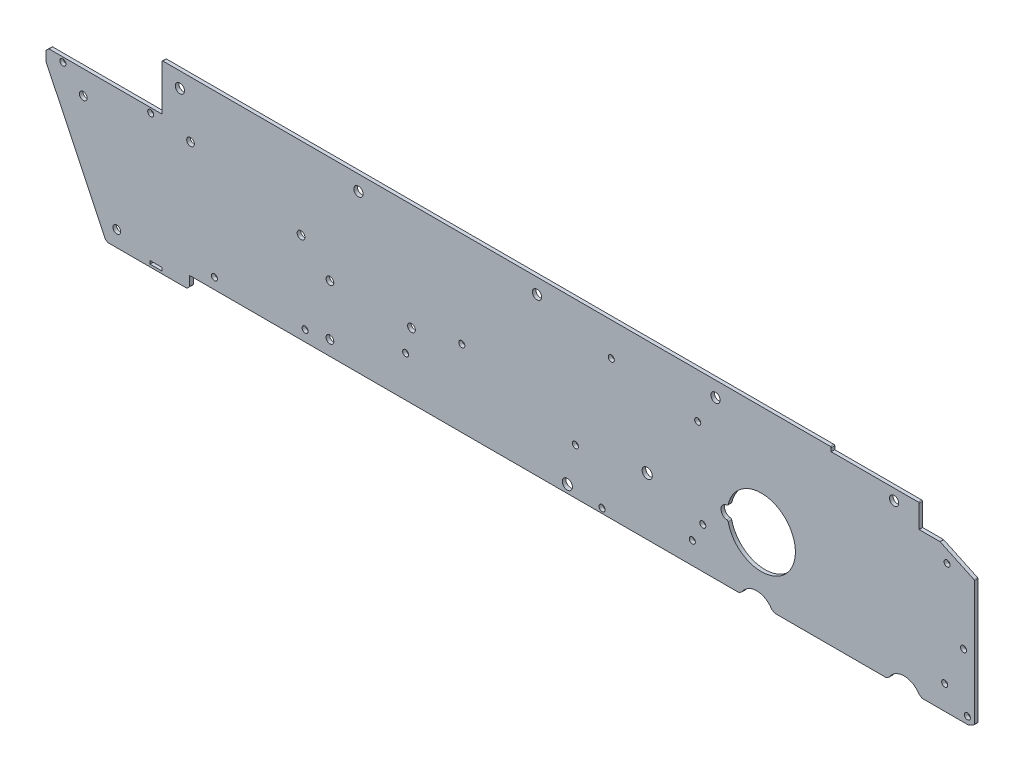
SolidWorks part; units mm, degrees
ref_plane "Plane1" through (0, 0, 0) normal (0, 0, 1) x (1, 0, 0)
ref_plane "Plane2" through (0, 0, 0) normal (0, 1, 0) x (1, 0, 0)
ref_plane "Plane3" through (0, 0, 0) normal (1, 0, 0) x (0, 0, -1)
sketch "Sketch1" plane through (0, 0, 0) normal (0, 0, 1) x (1, 0, 0)
  line L0 (0, 0) -> (0, -26.0096)
  line L1 (0, -26.0096) -> (-64.9986, -26.0096)
  line L2 (-64.9986, -26.0096) -> (-64.9986, -33.02)
  line L3 (-64.9986, -33.02) -> (-31.2674, -103.505)
  line L4 (-31.2674, -103.505) -> (15.494, -103.505)
  line L5 (15.494, -103.505) -> (15.494, -96.52)
  line L6 (15.494, -96.52) -> (454.9902, -96.52)
  line L7 (454.9902, -96.52) -> (454.9902, -24.511)
  line L8 (454.9902, -24.511) -> (435.7116, -15.494)
  line L9 (435.7116, -15.494) -> (424.0022, -15.494)
  line L10 (424.0022, -15.494) -> (424.0022, -2.3876)
  line L11 (424.0022, -2.3876) -> (374.777, -2.3876)
  line L12 (374.777, -2.3876) -> (374.777, 0)
  line L13 (374.777, 0) -> (0, 0)
  dimension "D1" = 439.7756
  dimension "D2" = 489.0008
  dimension "D3" = 500.7102
  dimension "D4" = 519.9888
  dimension "D5" = 64.9986
  dimension "D6" = 2.3876
  dimension "D7" = 26.0096
  dimension "D8" = 15.494
  dimension "D9" = 24.511
  dimension "D10" = 96.52
  dimension "D11" = 80.4926
  dimension "D12" = 103.505
  dimension "D13" = 33.7312
  dimension "D14" = 33.02
extrude "Base-Extrude" add sketch "Sketch1" along normal blind 2.286
sketch "Sketch2" plane through (0, 0, 2.286) normal (0, 0, 1) x (1, 0, 0)
  line L0 (454.9902, -96.52) -> (454.9902, -24.511) construction
  line L1 (15.494, -96.52) -> (454.9902, -96.52) construction
  circle A0 centre (415.6202, -100.33) radius 9.652
  dimension "D1" = 39.37
  dimension "D2" = 3.81
  dimension "D3" = 19.304
extrude "Cut-Extrude1" cut sketch "Sketch2" against normal through all
chamfer "Chamfer3" distance 1.524 angle 30 2 edges at (406.752, -96.52, 1.143) (424.4884, -96.52, 1.143)
pattern_linear "LPattern1" count 2 spacing 82.55 along (-1, 0, 0) of "Cut-Extrude1", "Chamfer3"
hole_wizard "Hole2" positions "Sketch6" profile "Sketch5" legacy
sketch "Sketch6" plane through (0, 0, 0) normal (0, 0, -1) x (-1, 0, 0)
  line L0 (-374.777, 0) -> (0, 0) construction
  line L1 (64.9986, -26.0096) -> (64.9986, -33.02) construction
  point P0 (-29.337, -90.424)
  dimension "D1" = 90.424
  dimension "D2" = 94.3356
sketch "Sketch5" plane through (29.337, -90.424, 0) normal (1, 0, 0) x (0, 1, 0)
  line L0 (0, 0) -> (0, 2.286)
  line L1 (0, 2.286) -> (1.5875, 2.286)
  line L2 (1.5875, 2.286) -> (1.5875, 1.5875)
  line L3 (1.5875, 1.5875) -> (3.175, 0)
  line L4 (3.175, 0) -> (0, 0)
  line L5 (0, -6.4453) -> (0, 115.525) construction
  line L6 (-1.5875, 1.5875) -> (-3.175, 0) construction
  dimension "Diameter" = 3.175
  dimension "Depth" = 2.286
  dimension "C-Sink Angle" = 90
  dimension "C-Sink Diameter" = 6.35
hole_wizard "Hole3" positions "Sketch8" profile "Sketch7" legacy
sketch "Sketch8" plane through (0, 0, 0) normal (0, 0, -1) x (-1, 0, 0)
  line L0 (-374.777, 0) -> (0, 0) construction
  line L1 (64.9986, -26.0096) -> (64.9986, -33.02) construction
  point P0 (-80.137, -90.424)
  dimension "D1" = 90.424
  dimension "D2" = 145.1356
sketch "Sketch7" plane through (80.137, -90.424, 0) normal (1, 0, 0) x (0, 1, 0)
  line L0 (0, 0) -> (0, 2.286)
  line L1 (0, 2.286) -> (1.5875, 2.286)
  line L2 (1.5875, 2.286) -> (1.5875, 1.5875)
  line L3 (1.5875, 1.5875) -> (3.175, 0)
  line L4 (3.175, 0) -> (0, 0)
  line L5 (0, -6.4453) -> (0, 115.525) construction
  line L6 (-1.5875, 1.5875) -> (-3.175, 0) construction
  dimension "Diameter" = 3.175
  dimension "Depth" = 2.286
  dimension "C-Sink Angle" = 90
  dimension "C-Sink Diameter" = 6.35
hole_wizard "Hole4" positions "Sketch10" profile "Sketch9" legacy
sketch "Sketch10" plane through (0, 0, 0) normal (0, 0, -1) x (-1, 0, 0)
  line L0 (64.9986, -26.0096) -> (64.9986, -33.02) construction
  line L1 (-374.777, 0) -> (0, 0) construction
  point P0 (55.5752, -28.6766)
  dimension "D1" = 9.4234
  dimension "D2" = 28.6766
sketch "Sketch9" plane through (-55.5752, -28.6766, 0) normal (1, 0, 0) x (0, 1, 0)
  line L0 (0, 0) -> (0, 2.286)
  line L1 (0, 2.286) -> (1.5875, 2.286)
  line L2 (1.5875, 2.286) -> (1.5875, 1.5875)
  line L3 (1.5875, 1.5875) -> (3.175, 0)
  line L4 (3.175, 0) -> (0, 0)
  line L5 (0, -6.4453) -> (0, 115.525) construction
  line L6 (-1.5875, 1.5875) -> (-3.175, 0) construction
  dimension "Diameter" = 3.175
  dimension "Depth" = 2.286
  dimension "C-Sink Angle" = 90
  dimension "C-Sink Diameter" = 6.35
hole_wizard "Hole5" positions "Sketch12" profile "Sketch11" legacy
sketch "Sketch12" plane through (0, 0, 0) normal (0, 0, -1) x (-1, 0, 0)
  line L0 (-374.777, 0) -> (0, 0) construction
  line L1 (64.9986, -26.0096) -> (64.9986, -33.02) construction
  point P0 (6.35, -28.6766)
  dimension "D1" = 28.6766
  dimension "D2" = 58.6486
sketch "Sketch11" plane through (-6.35, -28.6766, 0) normal (1, 0, 0) x (0, 1, 0)
  line L0 (0, 0) -> (0, 2.286)
  line L1 (0, 2.286) -> (1.5875, 2.286)
  line L2 (1.5875, 2.286) -> (1.5875, 1.5875)
  line L3 (1.5875, 1.5875) -> (3.175, 0)
  line L4 (3.175, 0) -> (0, 0)
  line L5 (0, -6.4453) -> (0, 115.525) construction
  line L6 (-1.5875, 1.5875) -> (-3.175, 0) construction
  dimension "Diameter" = 3.175
  dimension "Depth" = 2.286
  dimension "C-Sink Angle" = 90
  dimension "C-Sink Diameter" = 6.35
hole_wizard "Hole6" positions "Sketch14" profile "Sketch13" legacy
sketch "Sketch14" plane through (0, 0, 0) normal (0, 0, -1) x (-1, 0, 0)
  line L0 (-374.777, 0) -> (0, 0) construction
  line L1 (64.9986, -26.0096) -> (64.9986, -33.02) construction
  point P0 (-136.4488, -73.7108)
  dimension "D1" = 73.7108
  dimension "D2" = 201.4474
sketch "Sketch13" plane through (136.4488, -73.7108, 0) normal (1, 0, 0) x (0, 1, 0)
  line L0 (0, 0) -> (0, 2.286)
  line L1 (0, 2.286) -> (1.5875, 2.286)
  line L2 (1.5875, 2.286) -> (1.5875, 1.5875)
  line L3 (1.5875, 1.5875) -> (3.175, 0)
  line L4 (3.175, 0) -> (0, 0)
  line L5 (0, -6.4453) -> (0, 115.525) construction
  line L6 (-1.5875, 1.5875) -> (-3.175, 0) construction
  dimension "Diameter" = 3.175
  dimension "Depth" = 2.286
  dimension "C-Sink Angle" = 90
  dimension "C-Sink Diameter" = 6.35
hole_wizard "Hole7" positions "Sketch16" profile "Sketch15" legacy
sketch "Sketch16" plane through (0, 0, 0) normal (0, 0, -1) x (-1, 0, 0)
  line L0 (-374.777, 0) -> (0, 0) construction
  line L1 (64.9986, -26.0096) -> (64.9986, -33.02) construction
  point P0 (-246.4562, -93.853)
  dimension "D1" = 93.853
  dimension "D2" = 311.4548
sketch "Sketch15" plane through (246.4562, -93.853, 0) normal (1, 0, 0) x (0, 1, 0)
  line L0 (0, 0) -> (0, 2.286)
  line L1 (0, 2.286) -> (1.5875, 2.286)
  line L2 (1.5875, 2.286) -> (1.5875, 1.5875)
  line L3 (1.5875, 1.5875) -> (3.175, 0)
  line L4 (3.175, 0) -> (0, 0)
  line L5 (0, -6.4453) -> (0, 115.525) construction
  line L6 (-1.5875, 1.5875) -> (-3.175, 0) construction
  dimension "Diameter" = 3.175
  dimension "Depth" = 2.286
  dimension "C-Sink Angle" = 90
  dimension "C-Sink Diameter" = 6.35
hole_wizard "Hole8" positions "Sketch18" profile "Sketch17" legacy
sketch "Sketch18" plane through (0, 0, 0) normal (0, 0, -1) x (-1, 0, 0)
  line L0 (-425.6468, -96.52) -> (-454.9902, -96.52) construction
  line L1 (-454.9902, -96.52) -> (-454.9902, -24.511) construction
  point P0 (-451.0278, -92.5576)
  dimension "D1" = 3.9624
  dimension "D2" = 3.9624
sketch "Sketch17" plane through (451.0278, -92.5576, 0) normal (1, 0, 0) x (0, 1, 0)
  line L0 (0, 0) -> (0, 2.286)
  line L1 (0, 2.286) -> (1.5875, 2.286)
  line L2 (1.5875, 2.286) -> (1.5875, 1.5875)
  line L3 (1.5875, 1.5875) -> (3.175, 0)
  line L4 (3.175, 0) -> (0, 0)
  line L5 (0, -6.4453) -> (0, 115.525) construction
  line L6 (-1.5875, 1.5875) -> (-3.175, 0) construction
  dimension "Diameter" = 3.175
  dimension "Depth" = 2.286
  dimension "C-Sink Angle" = 90
  dimension "C-Sink Diameter" = 6.35
hole_wizard "Hole9" positions "Sketch20" profile "Sketch19" legacy
sketch "Sketch20" plane through (0, 0, 0) normal (0, 0, -1) x (-1, 0, 0)
  line L0 (-425.6468, -96.52) -> (-454.9902, -96.52) construction
  line L1 (-454.9902, -96.52) -> (-454.9902, -24.511) construction
  point P0 (-438.3278, -83.0072)
  dimension "D1" = 13.5128
  dimension "D2" = 16.6624
sketch "Sketch19" plane through (438.3278, -83.0072, 0) normal (1, 0, 0) x (0, 1, 0)
  line L0 (0, 0) -> (0, 2.286)
  line L1 (0, 2.286) -> (1.5875, 2.286)
  line L2 (1.5875, 2.286) -> (1.5875, 1.5875)
  line L3 (1.5875, 1.5875) -> (3.175, 0)
  line L4 (3.175, 0) -> (0, 0)
  line L5 (0, -6.4453) -> (0, 115.525) construction
  line L6 (-1.5875, 1.5875) -> (-3.175, 0) construction
  dimension "Diameter" = 3.175
  dimension "Depth" = 2.286
  dimension "C-Sink Angle" = 90
  dimension "C-Sink Diameter" = 6.35
hole_wizard "Hole10" positions "Sketch22" profile "Sketch21" legacy
sketch "Sketch22" plane through (0, 0, 0) normal (0, 0, -1) x (-1, 0, 0)
  line L0 (-454.9902, -96.52) -> (-454.9902, -24.511) construction
  line L1 (-425.6468, -96.52) -> (-454.9902, -96.52) construction
  point P0 (-448.8942, -60.96)
  dimension "D1" = 6.096
  dimension "D2" = 35.56
sketch "Sketch21" plane through (448.8942, -60.96, 0) normal (1, 0, 0) x (0, 1, 0)
  line L0 (0, 0) -> (0, 2.286)
  line L1 (0, 2.286) -> (1.5875, 2.286)
  line L2 (1.5875, 2.286) -> (1.5875, 1.5875)
  line L3 (1.5875, 1.5875) -> (3.175, 0)
  line L4 (3.175, 0) -> (0, 0)
  line L5 (0, -6.4453) -> (0, 115.525) construction
  line L6 (-1.5875, 1.5875) -> (-3.175, 0) construction
  dimension "Diameter" = 3.175
  dimension "Depth" = 2.286
  dimension "C-Sink Angle" = 90
  dimension "C-Sink Diameter" = 6.35
hole_wizard "Hole11" positions "Sketch24" profile "Sketch23" legacy
sketch "Sketch24" plane through (0, 0, 0) normal (0, 0, -1) x (-1, 0, 0)
  line L0 (-374.777, 0) -> (0, 0) construction
  line L1 (-454.9902, -96.52) -> (-454.9902, -24.511) construction
  point P0 (-439.674, -24.0792)
  dimension "D1" = 24.0792
  dimension "D2" = 15.3162
sketch "Sketch23" plane through (439.674, -24.0792, 0) normal (1, 0, 0) x (0, 1, 0)
  line L0 (0, 0) -> (0, 2.286)
  line L1 (0, 2.286) -> (1.5875, 2.286)
  line L2 (1.5875, 2.286) -> (1.5875, 1.5875)
  line L3 (1.5875, 1.5875) -> (3.175, 0)
  line L4 (3.175, 0) -> (0, 0)
  line L5 (0, -6.4453) -> (0, 115.525) construction
  line L6 (-1.5875, 1.5875) -> (-3.175, 0) construction
  dimension "Diameter" = 3.175
  dimension "Depth" = 2.286
  dimension "C-Sink Angle" = 90
  dimension "C-Sink Diameter" = 6.35
hole_wizard "Hole12" positions "Sketch26" profile "Sketch25" legacy
sketch "Sketch26" plane through (0, 0, 0) normal (0, 0, -1) x (-1, 0, 0)
  line L0 (-454.9902, -96.52) -> (-454.9902, -24.511) construction
  line L1 (-374.777, 0) -> (0, 0) construction
  point P0 (-296.9768, -84.2518)
  dimension "D1" = 158.0134
  dimension "D2" = 84.2518
sketch "Sketch25" plane through (296.9768, -84.2518, 0) normal (1, 0, 0) x (0, 1, 0)
  line L0 (0, 0) -> (0, 2.286)
  line L1 (0, 2.286) -> (1.5875, 2.286)
  line L2 (1.5875, 2.286) -> (1.5875, 1.5875)
  line L3 (1.5875, 1.5875) -> (3.175, 0)
  line L4 (3.175, 0) -> (0, 0)
  line L5 (0, -6.4453) -> (0, 115.525) construction
  line L6 (-1.5875, 1.5875) -> (-3.175, 0) construction
  dimension "Diameter" = 3.175
  dimension "Depth" = 2.286
  dimension "C-Sink Angle" = 90
  dimension "C-Sink Diameter" = 6.35
hole_wizard "Hole13" positions "Sketch28" profile "Sketch27" legacy
sketch "Sketch28" plane through (0, 0, 0) normal (0, 0, -1) x (-1, 0, 0)
  line L0 (-454.9902, -96.52) -> (-454.9902, -24.511) construction
  line L1 (-374.777, 0) -> (0, 0) construction
  point P0 (-302.8442, -73.6092)
  dimension "D1" = 152.146
  dimension "D2" = 73.6092
sketch "Sketch27" plane through (302.8442, -73.6092, 0) normal (1, 0, 0) x (0, 1, 0)
  line L0 (0, 0) -> (0, 2.286)
  line L1 (0, 2.286) -> (1.5875, 2.286)
  line L2 (1.5875, 2.286) -> (1.5875, 1.5875)
  line L3 (1.5875, 1.5875) -> (3.175, 0)
  line L4 (3.175, 0) -> (0, 0)
  line L5 (0, -6.4453) -> (0, 115.525) construction
  line L6 (-1.5875, 1.5875) -> (-3.175, 0) construction
  dimension "Diameter" = 3.175
  dimension "Depth" = 2.286
  dimension "C-Sink Angle" = 90
  dimension "C-Sink Diameter" = 6.35
hole_wizard "Hole14" positions "Sketch30" profile "Sketch29" legacy
sketch "Sketch30" plane through (0, 0, 0) normal (0, 0, -1) x (-1, 0, 0)
  line L0 (-374.777, 0) -> (0, 0) construction
  line L1 (-454.9902, -96.52) -> (-454.9902, -24.511) construction
  point P0 (-410.0068, -8.509)
  dimension "D1" = 8.509
  dimension "D2" = 44.9834
sketch "Sketch29" plane through (410.0068, -8.509, 0) normal (1, 0, 0) x (0, 1, 0)
  line L0 (0, 0) -> (0, 2.286)
  line L1 (0, 2.286) -> (2.159, 2.286)
  line L2 (2.159, 2.286) -> (2.159, 1.905)
  line L3 (2.159, 1.905) -> (4.064, 0)
  line L4 (4.064, 0) -> (0, 0)
  line L5 (0, -6.4453) -> (0, 115.525) construction
  line L6 (-2.159, 1.905) -> (-4.064, 0) construction
  dimension "Diameter" = 4.318
  dimension "Depth" = 2.286
  dimension "C-Sink Angle" = 90
  dimension "C-Sink Diameter" = 8.128
hole_wizard "Hole15" positions "Sketch32" profile "Sketch31" legacy
sketch "Sketch32" plane through (0, 0, 0) normal (0, 0, -1) x (-1, 0, 0)
  line L0 (-374.777, 0) -> (0, 0) construction
  line L1 (-454.9902, -96.52) -> (-454.9902, -24.511) construction
  point P0 (-309.9816, -8.509)
  dimension "D1" = 8.509
  dimension "D2" = 145.0086
sketch "Sketch31" plane through (309.9816, -8.509, 0) normal (1, 0, 0) x (0, 1, 0)
  line L0 (0, 0) -> (0, 2.286)
  line L1 (0, 2.286) -> (2.159, 2.286)
  line L2 (2.159, 2.286) -> (2.159, 1.905)
  line L3 (2.159, 1.905) -> (4.064, 0)
  line L4 (4.064, 0) -> (0, 0)
  line L5 (0, -6.4453) -> (0, 115.525) construction
  line L6 (-2.159, 1.905) -> (-4.064, 0) construction
  dimension "Diameter" = 4.318
  dimension "Depth" = 2.286
  dimension "C-Sink Angle" = 90
  dimension "C-Sink Diameter" = 8.128
hole_wizard "Hole16" positions "Sketch34" profile "Sketch33" legacy
sketch "Sketch34" plane through (0, 0, 0) normal (0, 0, -1) x (-1, 0, 0)
  line L0 (-374.777, 0) -> (0, 0) construction
  line L1 (-454.9902, -96.52) -> (-454.9902, -24.511) construction
  point P0 (-209.9818, -8.509)
  dimension "D1" = 8.509
  dimension "D2" = 245.0084
sketch "Sketch33" plane through (209.9818, -8.509, 0) normal (1, 0, 0) x (0, 1, 0)
  line L0 (0, 0) -> (0, 2.286)
  line L1 (0, 2.286) -> (2.159, 2.286)
  line L2 (2.159, 2.286) -> (2.159, 1.905)
  line L3 (2.159, 1.905) -> (4.064, 0)
  line L4 (4.064, 0) -> (0, 0)
  line L5 (0, -6.4453) -> (0, 115.525) construction
  line L6 (-2.159, 1.905) -> (-4.064, 0) construction
  dimension "Diameter" = 4.318
  dimension "Depth" = 2.286
  dimension "C-Sink Angle" = 90
  dimension "C-Sink Diameter" = 8.128
hole_wizard "Hole17" positions "Sketch36" profile "Sketch35" legacy
sketch "Sketch36" plane through (0, 0, 0) normal (0, 0, -1) x (-1, 0, 0)
  line L0 (-374.777, 0) -> (0, 0) construction
  line L1 (-454.9902, -96.52) -> (-454.9902, -24.511) construction
  point P0 (-109.982, -8.509)
  dimension "D1" = 8.509
  dimension "D2" = 345.0082
sketch "Sketch35" plane through (109.982, -8.509, 0) normal (1, 0, 0) x (0, 1, 0)
  line L0 (0, 0) -> (0, 2.286)
  line L1 (0, 2.286) -> (2.159, 2.286)
  line L2 (2.159, 2.286) -> (2.159, 1.905)
  line L3 (2.159, 1.905) -> (4.064, 0)
  line L4 (4.064, 0) -> (0, 0)
  line L5 (0, -6.4453) -> (0, 115.525) construction
  line L6 (-2.159, 1.905) -> (-4.064, 0) construction
  dimension "Diameter" = 4.318
  dimension "Depth" = 2.286
  dimension "C-Sink Angle" = 90
  dimension "C-Sink Diameter" = 8.128
hole_wizard "Hole18" positions "Sketch38" profile "Sketch37" legacy
sketch "Sketch38" plane through (0, 0, 0) normal (0, 0, -1) x (-1, 0, 0)
  line L0 (-374.777, 0) -> (0, 0) construction
  line L1 (-454.9902, -96.52) -> (-454.9902, -24.511) construction
  point P0 (-9.9822, -8.509)
  dimension "D1" = 8.509
  dimension "D2" = 445.008
sketch "Sketch37" plane through (9.9822, -8.509, 0) normal (1, 0, 0) x (0, 1, 0)
  line L0 (0, 0) -> (0, 2.286)
  line L1 (0, 2.286) -> (2.159, 2.286)
  line L2 (2.159, 2.286) -> (2.159, 1.905)
  line L3 (2.159, 1.905) -> (4.064, 0)
  line L4 (4.064, 0) -> (0, 0)
  line L5 (0, -6.4453) -> (0, 115.525) construction
  line L6 (-2.159, 1.905) -> (-4.064, 0) construction
  dimension "Diameter" = 4.318
  dimension "Depth" = 2.286
  dimension "C-Sink Angle" = 90
  dimension "C-Sink Diameter" = 8.128
hole_wizard "Hole19" positions "Sketch40" profile "Sketch39" legacy
sketch "Sketch40" plane through (0, 0, 0) normal (0, 0, -1) x (-1, 0, 0)
  line L0 (-374.777, 0) -> (0, 0) construction
  line L1 (-454.9902, -96.52) -> (-454.9902, -24.511) construction
  point P0 (44.1452, -39.243)
  dimension "D1" = 39.243
  dimension "D2" = 499.1354
sketch "Sketch39" plane through (-44.1452, -39.243, 0) normal (1, 0, 0) x (0, 1, 0)
  line L0 (0, 0) -> (0, 2.286)
  line L1 (0, 2.286) -> (2.159, 2.286)
  line L2 (2.159, 2.286) -> (2.159, 0)
  line L3 (2.159, 0) -> (0, 0)
  line L4 (0, 110) -> (0, -10) construction
  dimension "Diameter" = 4.318
  dimension "Depth" = 2.286
hole_wizard "Hole20" positions "Sketch43" profile "Sketch42" legacy
sketch "Sketch43" plane through (0, 0, 0) normal (0, 0, -1) x (-1, 0, 0)
  line L0 (-374.777, 0) -> (0, 0) construction
  line L1 (-454.9902, -96.52) -> (-454.9902, -24.511) construction
  point P0 (-15.9512, -31.4706)
  dimension "D1" = 31.4706
  dimension "D2" = 439.039
sketch "Sketch42" plane through (15.9512, -31.4706, 0) normal (1, 0, 0) x (0, 1, 0)
  line L0 (0, 0) -> (0, 2.286)
  line L1 (0, 2.286) -> (2.159, 2.286)
  line L2 (2.159, 2.286) -> (2.159, 0)
  line L3 (2.159, 0) -> (0, 0)
  line L4 (0, 110) -> (0, -10) construction
  dimension "Diameter" = 4.318
  dimension "Depth" = 2.286
hole_wizard "Hole21" positions "Sketch45" profile "Sketch44" legacy
sketch "Sketch45" plane through (0, 0, 0) normal (0, 0, -1) x (-1, 0, 0)
  line L0 (-374.777, 0) -> (0, 0) construction
  line L1 (-454.9902, -96.52) -> (-454.9902, -24.511) construction
  point P0 (25.3492, -94.615)
  dimension "D1" = 94.615
  dimension "D2" = 480.3394
sketch "Sketch44" plane through (-25.3492, -94.615, 0) normal (1, 0, 0) x (0, 1, 0)
  line L0 (0, 0) -> (0, 2.286)
  line L1 (0, 2.286) -> (2.159, 2.286)
  line L2 (2.159, 2.286) -> (2.159, 0)
  line L3 (2.159, 0) -> (0, 0)
  line L4 (0, 110) -> (0, -10) construction
  dimension "Diameter" = 4.318
  dimension "Depth" = 2.286
hole_wizard "Hole22" positions "Sketch47" profile "Sketch46" legacy
sketch "Sketch47" plane through (0, 0, 0) normal (0, 0, -1) x (-1, 0, 0)
  line L0 (-374.777, 0) -> (0, 0) construction
  line L1 (-454.9902, -96.52) -> (-454.9902, -24.511) construction
  point P0 (-94.0308, -88.265)
  dimension "D1" = 88.265
  dimension "D2" = 360.9594
sketch "Sketch46" plane through (94.0308, -88.265, 0) normal (1, 0, 0) x (0, 1, 0)
  line L0 (0, 0) -> (0, 2.286)
  line L1 (0, 2.286) -> (2.159, 2.286)
  line L2 (2.159, 2.286) -> (2.159, 0)
  line L3 (2.159, 0) -> (0, 0)
  line L4 (0, 110) -> (0, -10) construction
  dimension "Diameter" = 4.318
  dimension "Depth" = 2.286
hole_wizard "Hole23" positions "Sketch49" profile "Sketch48" legacy
sketch "Sketch49" plane through (0, 0, 0) normal (0, 0, -1) x (-1, 0, 0)
  line L0 (-374.777, 0) -> (0, 0) construction
  line L1 (-454.9902, -96.52) -> (-454.9902, -24.511) construction
  point P0 (-94.0308, -59.817)
  dimension "D1" = 59.817
  dimension "D2" = 360.9594
sketch "Sketch48" plane through (94.0308, -59.817, 0) normal (1, 0, 0) x (0, 1, 0)
  line L0 (0, 0) -> (0, 2.286)
  line L1 (0, 2.286) -> (2.159, 2.286)
  line L2 (2.159, 2.286) -> (2.159, 0)
  line L3 (2.159, 0) -> (0, 0)
  line L4 (0, 110) -> (0, -10) construction
  dimension "Diameter" = 4.318
  dimension "Depth" = 2.286
hole_wizard "Hole24" positions "Sketch51" profile "Sketch50" legacy
sketch "Sketch51" plane through (0, 0, 0) normal (0, 0, -1) x (-1, 0, 0)
  line L0 (-374.777, 0) -> (0, 0) construction
  line L1 (-454.9902, -96.52) -> (-454.9902, -24.511) construction
  point P0 (-77.8256, -45.7708)
  dimension "D1" = 45.7708
  dimension "D2" = 377.1646
sketch "Sketch50" plane through (77.8256, -45.7708, 0) normal (1, 0, 0) x (0, 1, 0)
  line L0 (0, 0) -> (0, 2.286)
  line L1 (0, 2.286) -> (2.159, 2.286)
  line L2 (2.159, 2.286) -> (2.159, 0)
  line L3 (2.159, 0) -> (0, 0)
  line L4 (0, 110) -> (0, -10) construction
  dimension "Diameter" = 4.318
  dimension "Depth" = 2.286
hole_wizard "Hole25" positions "Sketch53" profile "Sketch52" legacy
sketch "Sketch53" plane through (0, 0, 0) normal (0, 0, -1) x (-1, 0, 0)
  line L0 (-374.777, 0) -> (0, 0) construction
  line L1 (-454.9902, -96.52) -> (-454.9902, -24.511) construction
  point P0 (-139.7, -59.817)
  dimension "D1" = 59.817
  dimension "D2" = 315.2902
sketch "Sketch52" plane through (139.7, -59.817, 0) normal (1, 0, 0) x (0, 1, 0)
  line L0 (0, 0) -> (0, 2.286)
  line L1 (0, 2.286) -> (2.159, 2.286)
  line L2 (2.159, 2.286) -> (2.159, 0)
  line L3 (2.159, 0) -> (0, 0)
  line L4 (0, 110) -> (0, -10) construction
  dimension "Diameter" = 4.318
  dimension "Depth" = 2.286
hole_wizard "Hole26" positions "Sketch55" profile "Sketch54" legacy
sketch "Sketch55" plane through (0, 0, 0) normal (0, 0, -1) x (-1, 0, 0)
  line L0 (-374.777, 0) -> (0, 0) construction
  line L1 (-454.9902, -96.52) -> (-454.9902, -24.511) construction
  point P0 (-285.844, -83.0148)
  dimension "D1" = 83.0148
  dimension "D2" = 169.1462
sketch "Sketch54" plane through (285.844, -83.0148, 0) normal (1, 0, 0) x (0, 1, 0)
  line L0 (0, 0) -> (0, 2.286)
  line L1 (0, 2.286) -> (1.0438, 2.286)
  line L2 (1.0438, 2.286) -> (1.0438, 0)
  line L3 (1.0438, 0) -> (0, 0)
  line L4 (0, 110) -> (0, -10) construction
  dimension "Diameter" = 2.0876
  dimension "Depth" = 2.286
hole_wizard "Hole27" positions "Sketch57" profile "Sketch56" legacy
sketch "Sketch57" plane through (0, 0, 0) normal (0, 0, -1) x (-1, 0, 0)
  line L0 (-374.777, 0) -> (0, 0) construction
  line L1 (-454.9902, -96.52) -> (-454.9902, -24.511) construction
  point P0 (-308.069, -86.9823)
  dimension "D1" = 86.9823
  dimension "D2" = 146.9212
sketch "Sketch56" plane through (308.069, -86.9823, 0) normal (1, 0, 0) x (0, 1, 0)
  line L0 (0, 0) -> (0, 2.286)
  line L1 (0, 2.286) -> (1.0438, 2.286)
  line L2 (1.0438, 2.286) -> (1.0438, 0)
  line L3 (1.0438, 0) -> (0, 0)
  line L4 (0, 110) -> (0, -10) construction
  dimension "Diameter" = 2.0876
  dimension "Depth" = 2.286
hole_wizard "Hole28" positions "Sketch59" profile "Sketch58" legacy
sketch "Sketch59" plane through (0, 0, 0) normal (0, 0, -1) x (-1, 0, 0)
  line L0 (-374.777, 0) -> (0, 0) construction
  line L1 (-454.9902, -96.52) -> (-454.9902, -24.511) construction
  point P0 (-271.714, -64.2696)
  dimension "D1" = 64.2696
  dimension "D2" = 183.2762
sketch "Sketch58" plane through (271.714, -64.2696, 0) normal (1, 0, 0) x (0, 1, 0)
  line L0 (0, 0) -> (0, 2.286)
  line L1 (0, 2.286) -> (2.85, 2.286)
  line L2 (2.85, 2.286) -> (2.85, 0)
  line L3 (2.85, 0) -> (0, 0)
  line L4 (0, 110) -> (0, -10) construction
  dimension "Diameter" = 5.7
  dimension "Depth" = 2.286
hole_wizard "Hole29" positions "Sketch61" profile "Sketch60" legacy
sketch "Sketch61" plane through (0, 0, 0) normal (0, 0, -1) x (-1, 0, 0)
  line L0 (-374.777, 0) -> (0, 0) construction
  line L1 (-454.9902, -96.52) -> (-454.9902, -24.511) construction
  point P0 (-226.9947, -92.009)
  dimension "D1" = 92.009
  dimension "D2" = 227.9955
sketch "Sketch60" plane through (226.9947, -92.009, 0) normal (1, 0, 0) x (0, 1, 0)
  line L0 (0, 0) -> (0, 2.286)
  line L1 (0, 2.286) -> (2.85, 2.286)
  line L2 (2.85, 2.286) -> (2.85, 0)
  line L3 (2.85, 0) -> (0, 0)
  line L4 (0, 110) -> (0, -10) construction
  dimension "Diameter" = 5.7
  dimension "Depth" = 2.286
hole_wizard "Hole30" positions "Sketch63" profile "Sketch62" legacy
sketch "Sketch63" plane through (0, 0, 0) normal (0, 0, -1) x (-1, 0, 0)
  line L0 (-374.777, 0) -> (0, 0) construction
  line L1 (-454.9902, -96.52) -> (-454.9902, -24.511) construction
  point P0 (-359.9942, -8.509)
  dimension "D1" = 8.509
  dimension "D2" = 94.996
sketch "Sketch62" plane through (359.9942, -8.509, 0) normal (1, 0, 0) x (0, 1, 0)
  line L0 (0, 0) -> (0, 2.286)
  line L1 (0, 2.286) -> (1.4502, 2.286)
  line L2 (1.4502, 2.286) -> (1.4502, 0)
  line L3 (1.4502, 0) -> (0, 0)
  line L4 (0, 110) -> (0, -10) construction
  dimension "Diameter" = 2.9004
  dimension "Depth" = 2.286
sketch "Sketch64" plane through (0, 0, 0) normal (0, 0, -1) x (-1, 0, 0)
  line L0 (-56.8198, -10.1092) -> (-63.1698, -10.1092)
  line L1 (-56.8198, -6.9088) -> (-63.1698, -6.9088)
  line L3 (-454.9902, -96.52) -> (-454.9902, -24.511) construction
  line L4 (-374.777, 0) -> (0, 0) construction
  arc A0 (-56.8198, -10.1092) -> (-56.8198, -6.9088) centre (-56.8198, -8.509) ccw
  arc A1 (-63.1698, -6.9088) -> (-63.1698, -10.1092) centre (-63.1698, -8.509) ccw
  dimension "D2" = 6.35
  dimension "D4" = 391.8204
  dimension "D1" = 3.2004
  dimension "D3" = 8.509
extrude "Cut-Extrude2" cut sketch "Sketch64" against normal through all
sketch "Sketch65" plane through (0, 0, 0) normal (0, 0, -1) x (-1, 0, 0)
  line L0 (6.731, -102.1334) -> (0.127, -102.1334)
  line L1 (6.731, -102.1334) -> (6.731, -100.3554)
  line L2 (0.127, -100.3554) -> (6.731, -100.3554)
  line L3 (0.127, -100.3554) -> (0.127, -102.1334)
  line L4 (-454.9902, -96.52) -> (-454.9902, -24.511) construction
  line L5 (31.2674, -103.505) -> (-15.494, -103.505) construction
  dimension "D1" = 6.604
  dimension "D2" = 1.778
  dimension "D3" = 455.1172
  dimension "D4" = 1.3716
extrude "Cut-Extrude3" cut sketch "Sketch65" against normal through all
chamfer "Chamfer1" distance 3.175 angle 30 1 edges at (454.9902, -96.52, 1.143)
chamfer "Chamfer2" distance 1.524 angle 45 3 edges at (15.494, -103.505, 1.143) (-31.2674, -103.505, 1.143) (-64.9986, -26.0096, 1.143)
sketch "Sketch66" plane through (0, 0, 2.286) normal (0, 0, 1) x (1, 0, 0)
  circle A0 centre (194.1068, -39.8018) radius 20.6375
  circle A1 centre (359.9942, -8.509) radius 1.4502 construction
  dimension "D1" = 41.275
  dimension "D2" = 31.2928
  dimension "D3" = 165.8874
extrude "Cut-Extrude4" [suppressed] cut sketch "Sketch66" against normal blind 1.27
sketch "Sketch71" plane through (0, 0, 2.286) normal (0, 0, 1) x (1, 0, 0)
  arc A0 (316.9429, -64.5767) -> (316.9429, -57.4957) centre (335.661, -61.0362) ccw
  arc A1 (316.9429, -57.4957) -> (316.9429, -64.5767) centre (316.611, -61.0362) ccw
  circle A2 centre (359.9942, -8.509) radius 1.4502 construction
  dimension "D1" = 38.1
  dimension "D2" = 7.112
  dimension "D4" = 24.3332
  dimension "D3" = 52.5272
  dimension "D5" = 19.05
extrude "Cut-Extrude5" cut sketch "Sketch71" against normal through all
sketch "Sketch73" plane through (0, 0, 2.286) normal (0, 0, 1) x (1, 0, 0)
  circle A0 centre (167.8686, -21.8694) radius 1.45
  circle A1 centre (359.9942, -8.509) radius 1.4502 construction
  dimension "D1" = 2.9
  dimension "D2" = 192.1256
  dimension "D3" = 13.3604
extrude "Cut-Extrude6" cut sketch "Sketch73" against normal through all
hole_wizard "Hole31" positions "Sketch76" profile "Sketch75" legacy
sketch "Sketch76" plane through (0, 0, 0) normal (0, 0, -1) x (-1, 0, 0)
  circle A0 centre (-359.9942, -8.509) radius 1.4502 construction
  point P0 (-167.8686, -53.6194)
  dimension "D2" = 45.1104
  dimension "D1" = 192.1256
sketch "Sketch75" plane through (167.8686, -53.6194, 0) normal (1, 0, 0) x (0, 1, 0)
  line L0 (0, 0) -> (0, 100)
  line L1 (0, 100) -> (1.5875, 100)
  line L2 (1.5875, 100) -> (1.5875, 1.5875)
  line L3 (1.5875, 1.5875) -> (3.175, 0)
  line L4 (3.175, 0) -> (0, 0)
  line L5 (0, -6.4453) -> (0, 115.525) construction
  line L6 (-1.5875, 1.5875) -> (-3.175, 0) construction
  dimension "Diameter" = 3.175
  dimension "Depth" = 100
  dimension "C-Sink Angle" = 90
  dimension "C-Sink Diameter" = 6.35
hole_wizard "Hole32" positions "Sketch78" profile "Sketch77" legacy
sketch "Sketch78" plane through (0, 0, 0) normal (0, 0, -1) x (-1, 0, 0)
  circle A0 centre (-359.9942, -8.509) radius 1.4502 construction
  point P0 (-231.521, -70.6882)
  dimension "D1" = 128.4732
  dimension "D2" = 62.1792
sketch "Sketch77" plane through (231.521, -70.6882, 0) normal (1, 0, 0) x (0, 1, 0)
  line L0 (0, 0) -> (0, 100)
  line L1 (0, 100) -> (1.5875, 100)
  line L2 (1.5875, 100) -> (1.5875, 1.5875)
  line L3 (1.5875, 1.5875) -> (3.175, 0)
  line L4 (3.175, 0) -> (0, 0)
  line L5 (0, -6.4453) -> (0, 115.525) construction
  line L6 (-1.5875, 1.5875) -> (-3.175, 0) construction
  dimension "Diameter" = 3.175
  dimension "Depth" = 100
  dimension "C-Sink Angle" = 90
  dimension "C-Sink Diameter" = 6.35
hole_wizard "Hole33" positions "Sketch81" profile "Sketch80" countersink size "M3" standard "Ansi Metric"
sketch "Sketch81" plane through (0, 0, 0) normal (0, 0, -1) x (-1, 0, 0)
  circle A0 centre (-359.9942, -8.509) radius 1.4502 construction
  point P0 (-251.6124, -18.6944)
  dimension "D1" = 108.3818
  dimension "D2" = 10.1854
sketch "Sketch80" plane through (251.6124, -18.6944, 0) normal (1, 0, 0) x (0, 1, 0)
  line L0 (0, 0) -> (0, 2.286)
  line L1 (0, 2.286) -> (1.7, 2.286)
  line L2 (1.7, 2.286) -> (1.7, 1.45)
  line L3 (1.7, 1.45) -> (3.15, 0)
  line L5 (3.15, 0) -> (0, 0)
  line L6 (-1.7, 1.45) -> (-3.15, 0) construction
  line L11 (0, -6.35) -> (0, 107.95) construction
  dimension "Thru Hole Dia." = 3.4
  dimension "Thru Hole Depth" = 2.286
  dimension "Near C'Sink Dia." = 6.3
  dimension "Near C'Sink Angle" = 90
hole_wizard "Hole34" positions "Sketch83" profile "Sketch82" legacy
sketch "Sketch83" plane through (0, 0, 0) normal (0, 0, -1) x (-1, 0, 0)
  circle A0 centre (-359.9942, -8.509) radius 1.4502 construction
  point P0 (-300.0248, -25.0444)
  dimension "D1" = 59.9694
  dimension "D2" = 16.5354
sketch "Sketch82" plane through (300.0248, -25.0444, 0) normal (1, 0, 0) x (0, 1, 0)
  line L0 (0, 0) -> (0, 100)
  line L1 (0, 100) -> (1.5875, 100)
  line L2 (1.5875, 100) -> (1.5875, 1.5875)
  line L3 (1.5875, 1.5875) -> (3.175, 0)
  line L4 (3.175, 0) -> (0, 0)
  line L5 (0, -6.4453) -> (0, 115.525) construction
  line L6 (-1.5875, 1.5875) -> (-3.175, 0) construction
  dimension "Diameter" = 3.175
  dimension "Depth" = 100
  dimension "C-Sink Angle" = 90
  dimension "C-Sink Diameter" = 6.35
hole_wizard "Hole35" positions "Sketch85" profile "Sketch84" legacy
sketch "Sketch85" plane through (0, 0, 0) normal (0, 0, -1) x (-1, 0, 0)
  circle A0 centre (-359.9942, -8.509) radius 1.4502 construction
  point P0 (-300.0248, -56.7944)
  dimension "D1" = 59.9694
  dimension "D2" = 48.2854
sketch "Sketch84" plane through (300.0248, -56.7944, 0) normal (1, 0, 0) x (0, 1, 0)
  line L0 (0, 0) -> (0, 2.286)
  line L1 (0, 2.286) -> (1.45, 2.286)
  line L2 (1.45, 2.286) -> (1.45, 0)
  line L3 (1.45, 0) -> (0, 0)
  line L4 (0, 110) -> (0, -10) construction
  dimension "Diameter" = 2.9
  dimension "Depth" = 2.286
sketch "Skizze5" plane through (0, 0, 0) normal (0, 0, -1) x (-1, 0, 0)
  line L27 (64.9986, -33.02) -> (64.9986, -27.5336)
  line L28 (64.9986, -27.5336) -> (63.4746, -26.0096)
  line L29 (63.4746, -26.0096) -> (57.2979, -26.0096)
  line L30 (53.8525, -26.0096) -> (8.0727, -26.0096)
  line L31 (4.6273, -26.0096) -> (0, -26.0096)
  line L32 (0, -26.0096) -> (0, 0)
  line L33 (0, 0) -> (-374.777, 0)
  line L34 (-374.777, 0) -> (-374.777, -2.3876)
  line L35 (-374.777, -2.3876) -> (-424.0022, -2.3876)
  line L36 (-424.0022, -2.3876) -> (-424.0022, -15.494)
  line L37 (-424.0022, -15.494) -> (-435.7116, -15.494)
  line L38 (-435.7116, -15.494) -> (-454.9902, -24.511)
  line L39 (-454.9902, -24.511) -> (-454.9902, -94.6869)
  line L40 (-454.9902, -94.6869) -> (-451.8152, -96.52)
  line L41 (-451.8152, -96.52) -> (-425.6468, -96.52)
  line L42 (-425.6468, -96.52) -> (-423.8968, -95.3642)
  line L43 (-407.3436, -95.3642) -> (-405.5936, -96.52)
  line L44 (-405.5936, -96.52) -> (-343.0968, -96.52)
  line L45 (-343.0968, -96.52) -> (-341.3468, -95.3642)
  line L46 (-324.7936, -95.3642) -> (-323.0436, -96.52)
  line L47 (-323.0436, -96.52) -> (-248.1789, -96.52)
  line L48 (-244.7335, -96.52) -> (-15.494, -96.52)
  line L49 (-15.494, -96.52) -> (-15.494, -101.981)
  line L50 (-15.494, -101.981) -> (-13.97, -103.505)
  line L51 (-13.97, -103.505) -> (30.3072, -103.505)
  line L52 (30.3072, -103.505) -> (31.6819, -102.6389)
  line L53 (31.6819, -102.6389) -> (64.9986, -33.02)
  line L54 (64.9986, -33.02) -> (64.9986, -27.5336)
  line L55 (64.9986, -27.5336) -> (63.4746, -26.0096)
  line L56 (63.4746, -26.0096) -> (57.2979, -26.0096)
  line L57 (53.8525, -26.0096) -> (8.0727, -26.0096)
  line L58 (4.6273, -26.0096) -> (0, -26.0096)
  line L59 (0, -26.0096) -> (0, 0)
  line L60 (0, 0) -> (-374.777, 0)
  line L61 (-374.777, 0) -> (-374.777, -2.3876)
  line L62 (-374.777, -2.3876) -> (-424.0022, -2.3876)
  line L63 (-424.0022, -2.3876) -> (-424.0022, -15.494)
  line L64 (-424.0022, -15.494) -> (-435.7116, -15.494)
  line L65 (-435.7116, -15.494) -> (-454.9902, -24.511)
  line L66 (-454.9902, -24.511) -> (-454.9902, -94.6869)
  line L67 (-454.9902, -94.6869) -> (-451.8152, -96.52)
  line L68 (-451.8152, -96.52) -> (-425.6468, -96.52)
  line L69 (-425.6468, -96.52) -> (-423.8968, -95.3642)
  line L70 (-407.3436, -95.3642) -> (-405.5936, -96.52)
  line L71 (-405.5936, -96.52) -> (-343.0968, -96.52)
  line L72 (-343.0968, -96.52) -> (-341.3468, -95.3642)
  line L73 (-324.7936, -95.3642) -> (-323.0436, -96.52)
  line L74 (-323.0436, -96.52) -> (-248.1789, -96.52)
  line L75 (-244.7335, -96.52) -> (-15.494, -96.52)
  line L76 (-15.494, -96.52) -> (-15.494, -101.981)
  line L77 (-15.494, -101.981) -> (-13.97, -103.505)
  line L78 (-13.97, -103.505) -> (30.3072, -103.505)
  line L79 (30.3072, -103.505) -> (31.6819, -102.6389)
  line L80 (31.6819, -102.6389) -> (64.9986, -33.02)
  arc A5 (53.8525, -26.0096) -> (57.2979, -26.0096) centre (55.5752, -28.6766) ccw
  arc A6 (4.6273, -26.0096) -> (8.0727, -26.0096) centre (6.35, -28.6766) ccw
  arc A7 (-407.3436, -95.3642) -> (-423.8968, -95.3642) centre (-415.6202, -100.33) ccw
  arc A8 (-324.7936, -95.3642) -> (-341.3468, -95.3642) centre (-333.0702, -100.33) ccw
  arc A9 (-244.7335, -96.52) -> (-248.1789, -96.52) centre (-246.4562, -93.853) ccw
  arc A10 (53.8525, -26.0096) -> (57.2979, -26.0096) centre (55.5752, -28.6766) ccw
  arc A11 (4.6273, -26.0096) -> (8.0727, -26.0096) centre (6.35, -28.6766) ccw
  arc A12 (-407.3436, -95.3642) -> (-423.8968, -95.3642) centre (-415.6202, -100.33) ccw
  arc A13 (-324.7936, -95.3642) -> (-341.3468, -95.3642) centre (-333.0702, -100.33) ccw
  arc A14 (-244.7335, -96.52) -> (-248.1789, -96.52) centre (-246.4562, -93.853) ccw
  dimension "D1" = 0
extrude "Schnitt-Linear austragen1" cut sketch "Skizze5" against normal offset from surface (0.286 mm away) 2
hole_wizard "Formsenkung für M3 Senkschraube mit Innensechskant1" positions "Skizze2" profile "Skizze1" countersink size "M3" standard "DIN"
sketch "Skizze2" plane through (-186.6426, 6.0222, 0.286) normal (0, 0, -1) x (-1, 0, 0)
  point P1 (-215.9796, -96.4462)
  point P4 (-131.0674, -34.6988)
  point P7 (-180.2926, -34.6988)
  point P10 (-266.7796, -96.4462)
  point P13 (-323.0914, -79.733)
  point P16 (-354.5112, -59.6416)
  point P19 (-433.0988, -99.8752)
  point P22 (-418.1636, -76.7104)
  point P25 (-438.255, -24.7166)
  point P28 (-624.9704, -89.0294)
  point P31 (-637.6704, -98.5798)
  point P34 (-635.5368, -66.9822)
  point P37 (-626.3166, -30.1014)
  point P40 (-486.6674, -31.0666)
  point P43 (-483.6194, -90.274)
  point P46 (-489.4868, -79.6314)
sketch "Skizze1" plane through (29.337, -90.424, 0.286) normal (1, 0, 0) x (0, 1, 0)
  line L0 (0, 0) -> (0, 2)
  line L1 (0, 2) -> (1.7, 2)
  line L2 (1.7, 2) -> (1.7, 1.77)
  line L3 (1.7, 1.77) -> (3.47, 0)
  line L5 (3.47, 0) -> (0, 0)
  line L6 (-1.7, 1.77) -> (-3.47, 0) construction
  line L11 (0, -6.35) -> (0, 107.95) construction
  dimension "Bohrerdurchmesser" = 3.4
  dimension "Bohrungstiefe" = 2
  dimension "Senkdurchmesser (Oben)" = 6.94
  dimension "Senkwinkel (Oben)" = 90
hole_wizard "Formsenkung für M4 Senkschraube mit Innensechskant1" positions "Skizze4" profile "Skizze3" countersink size "M4" standard "DIN"
sketch "Skizze4" plane through (-62.836, -24.0555, 0.286) normal (0, 0, -1) x (-1, 0, 0)
  point P1 (-72.8182, 15.5465)
  point P4 (-172.818, 15.5465)
  point P7 (-272.8178, 15.5465)
  point P10 (-372.8176, 15.5465)
  point P13 (-472.8428, 15.5465)
sketch "Skizze3" plane through (9.9822, -8.509, 0.286) normal (1, 0, 0) x (0, 1, 0)
  line L0 (0, 0) -> (0, 2)
  line L1 (0, 2) -> (2.25, 2)
  line L2 (2.25, 2) -> (2.25, 2.34)
  line L3 (2.25, 2.34) -> (4.59, 0)
  line L5 (4.59, 0) -> (0, 0)
  line L6 (-2.25, 2.34) -> (-4.59, 0) construction
  line L11 (0, -6.35) -> (0, 107.95) construction
  dimension "Bohrerdurchmesser" = 4.5
  dimension "Bohrungstiefe" = 2
  dimension "Senkdurchmesser (Oben)" = 9.18
  dimension "Senkwinkel (Oben)" = 90
hole_wizard "Formsenkung für M3 Senkschraube mit Innensechskant2" positions "Skizze7" profile "Skizze6" countersink size "M3" standard "DIN"
sketch "Skizze7" plane through (0, 0, 0.286) normal (0, 0, -1) x (-1, 0, 0)
  point P1 (-15.9512, -31.4706)
  point P4 (-77.8256, -45.7708)
  point P7 (-139.7, -59.817)
sketch "Skizze6" plane through (15.9512, -31.4706, 0.286) normal (1, 0, 0) x (0, 1, 0)
  line L0 (0, 0) -> (0, 2)
  line L1 (0, 2) -> (1.7, 2)
  line L2 (1.7, 2) -> (1.7, 1.77)
  line L3 (1.7, 1.77) -> (3.47, 0)
  line L5 (3.47, 0) -> (0, 0)
  line L6 (-1.7, 1.77) -> (-3.47, 0) construction
  line L11 (0, -6.35) -> (0, 107.95) construction
  dimension "Bohrerdurchmesser" = 3.4
  dimension "Bohrungstiefe" = 2
  dimension "Senkdurchmesser (Oben)" = 6.94
  dimension "Senkwinkel (Oben)" = 90
fillet "Verrundung1" radius 1 2 edges at (316.9429, -64.5767, 1.286) (316.9429, -57.4957, 1.286)
fillet "Verrundung2" radius 0.5 22 edges at (454.9902, -94.6869, 1.286) (451.8152, -96.52, 1.286) (425.6468, -96.52, 1.286) (423.8968, -95.3642, 1.286) (407.3436, -95.3642, 1.286) (405.5936, -96.52, 1.286) (343.0968, -96.52, 1.286) (341.3468, -95.3642, 1.286) (324.7936, -95.3642, 1.286) (323.0436, -96.52, 1.286) (15.494, -101.981, 1.286) (13.97, -103.505, 1.286) (-30.3072, -103.505, 1.286) (-31.6819, -102.6389, 1.286) (-64.9986, -33.02, 1.286) (-64.9986, -27.5336, 1.286) (-63.4746, -26.0096, 1.286) (0, 0, 1.286) (374.777, 0, 1.286) (424.0022, -2.3876, 1.286) (435.7116, -15.494, 1.286) (454.9902, -24.511, 1.286)
sketch "Skizze8" plane through (0, 0, 0.286) normal (0, 0, -1) x (-1, 0, 0)
  line L0 (0.127, -102.1334) -> (6.731, -102.1334) construction
  line L1 (6.731, -100.3554) -> (6.731, -102.1334) construction
  line L2 (6.731, -100.3554) -> (0.127, -100.3554) construction
  line L3 (0.127, -102.1334) -> (0.127, -100.3554) construction
  line L4 (0.127, -102.1334) -> (6.731, -102.1334)
  line L5 (6.731, -100.3554) -> (6.731, -102.1334)
  line L6 (6.731, -100.3554) -> (0.127, -100.3554)
  line L7 (0.127, -102.1334) -> (0.127, -100.3554)
  line L27 (-454.9902, -24.8291) -> (-454.9902, -94.3982)
  line L28 (-454.7402, -94.8313) -> (-451.9312, -96.453)
  line L29 (-451.6812, -96.52) -> (-425.797, -96.52)
  line L30 (-425.5214, -96.4372) -> (-423.9903, -95.4259)
  line L31 (-407.2501, -95.4259) -> (-405.719, -96.4372)
  line L32 (-405.4434, -96.52) -> (-343.247, -96.52)
  line L33 (-342.9714, -96.4372) -> (-341.4403, -95.4259)
  line L34 (-324.7001, -95.4259) -> (-323.169, -96.4372)
  line L35 (-322.8934, -96.52) -> (-248.6761, -96.52)
  line L36 (-244.2363, -96.52) -> (-15.494, -96.52)
  line L37 (-15.494, -96.52) -> (-15.494, -101.7739)
  line L38 (-15.3476, -102.1274) -> (-14.1164, -103.3586)
  line L39 (-13.7629, -103.505) -> (30.1628, -103.505)
  line L40 (30.4294, -103.428) -> (31.5597, -102.7158)
  line L41 (31.7442, -102.5086) -> (64.9496, -33.1224)
  line L42 (64.9986, -32.9065) -> (64.9986, -27.7407)
  line L43 (64.8522, -27.3872) -> (63.621, -26.156)
  line L44 (63.2675, -26.0096) -> (57.7951, -26.0096)
  line L45 (53.3553, -26.0096) -> (8.5699, -26.0096)
  line L46 (4.1301, -26.0096) -> (0, -26.0096)
  line L47 (0, -26.0096) -> (0, -0.5)
  line L48 (-0.5, 0) -> (-374.277, 0)
  line L49 (-374.777, -0.5) -> (-374.777, -2.3876)
  line L50 (-374.777, -2.3876) -> (-423.5022, -2.3876)
  line L51 (-424.0022, -2.8876) -> (-424.0022, -15.494)
  line L52 (-424.0022, -15.494) -> (-435.6004, -15.494)
  line L53 (-435.8123, -15.5411) -> (-454.702, -24.3762)
  line L54 (-454.9902, -24.8291) -> (-454.9902, -94.3982)
  line L55 (-454.7402, -94.8313) -> (-451.9312, -96.453)
  line L56 (-451.6812, -96.52) -> (-425.797, -96.52)
  line L57 (-425.5214, -96.4372) -> (-423.9903, -95.4259)
  line L58 (-407.2501, -95.4259) -> (-405.719, -96.4372)
  line L59 (-405.4434, -96.52) -> (-343.247, -96.52)
  line L60 (-342.9714, -96.4372) -> (-341.4403, -95.4259)
  line L61 (-324.7001, -95.4259) -> (-323.169, -96.4372)
  line L63 (-322.8934, -96.52) -> (-15.494, -96.52)
  line L64 (-15.494, -96.52) -> (-15.494, -101.7739)
  line L65 (-15.3476, -102.1274) -> (-14.1164, -103.3586)
  line L66 (-13.7629, -103.505) -> (30.1628, -103.505)
  line L67 (30.4294, -103.428) -> (31.5597, -102.7158)
  line L68 (31.7442, -102.5086) -> (64.9496, -33.1224)
  line L69 (64.9986, -32.9065) -> (64.9986, -27.7407)
  line L70 (64.8522, -27.3872) -> (63.621, -26.156)
  line L71 (63.2675, -26.0096) -> (0, -26.0096)
  line L74 (0, -26.0096) -> (0, -0.5)
  line L75 (-0.5, 0) -> (-374.277, 0)
  line L76 (-374.777, -0.5) -> (-374.777, -2.3876)
  line L77 (-374.777, -2.3876) -> (-423.5022, -2.3876)
  line L78 (-424.0022, -2.8876) -> (-424.0022, -15.494)
  line L79 (-424.0022, -15.494) -> (-435.6004, -15.494)
  line L80 (-435.8123, -15.5411) -> (-454.702, -24.3762)
  circle A0 centre (55.5752, -28.6766) radius 1.7 construction
  circle A1 centre (25.3492, -94.615) radius 2.159 construction
  circle A2 centre (44.1452, -39.243) radius 2.159 construction
  circle A3 centre (6.35, -28.6766) radius 1.7 construction
  circle A4 centre (-15.9512, -31.4706) radius 2.159 construction
  circle A5 centre (-9.9822, -8.509) radius 2.59 construction
  circle A6 centre (-29.337, -90.424) radius 1.7 construction
  circle A7 centre (-80.137, -90.424) radius 1.7 construction
  circle A8 centre (-77.8256, -45.7708) radius 2.159 construction
  circle A9 centre (-136.4488, -73.7108) radius 1.7 construction
  circle A10 centre (-94.0308, -59.817) radius 2.159 construction
  circle A11 centre (-94.0308, -88.265) radius 2.159 construction
  circle A12 centre (-139.7, -59.817) radius 2.159 construction
  circle A13 centre (-109.982, -8.509) radius 2.59 construction
  circle A14 centre (-167.8686, -53.6194) radius 1.7 construction
  circle A15 centre (-209.9818, -8.509) radius 2.59 construction
  circle A16 centre (-231.521, -70.6882) radius 1.7 construction
  circle A17 centre (-251.6124, -18.6944) radius 1.7 construction
  circle A18 centre (-271.714, -64.2696) radius 2.85 construction
  circle A19 centre (-226.9947, -92.009) radius 2.85 construction
  circle A20 centre (-296.9768, -84.2518) radius 1.7 construction
  circle A21 centre (-302.8442, -73.6092) radius 1.7 construction
  circle A22 centre (-300.0248, -25.0444) radius 1.7 construction
  circle A23 centre (-309.9816, -8.509) radius 2.59 construction
  circle A24 centre (-410.0068, -8.509) radius 2.59 construction
  circle A25 centre (-439.674, -24.0792) radius 1.7 construction
  circle A26 centre (-448.8942, -60.96) radius 1.7 construction
  arc A27 (-454.9902, -94.3982) -> (-454.7402, -94.8313) centre (-454.4902, -94.3982) ccw
  arc A28 (-451.9312, -96.453) -> (-451.6812, -96.52) centre (-451.6812, -96.02) ccw
  arc A29 (-425.797, -96.52) -> (-425.5214, -96.4372) centre (-425.797, -96.02) ccw
  arc A30 (-423.9903, -95.4259) -> (-423.84, -95.2708) centre (-424.2658, -95.0087) ccw
  arc A31 (-407.4004, -95.2708) -> (-423.84, -95.2708) centre (-415.6202, -100.33) ccw
  arc A32 (-407.4004, -95.2708) -> (-407.2501, -95.4259) centre (-406.9746, -95.0087) ccw
  arc A33 (-405.719, -96.4372) -> (-405.4434, -96.52) centre (-405.4434, -96.02) ccw
  arc A34 (-343.247, -96.52) -> (-342.9714, -96.4372) centre (-343.247, -96.02) ccw
  arc A35 (-341.4403, -95.4259) -> (-341.29, -95.2708) centre (-341.7158, -95.0087) ccw
  arc A36 (-324.8504, -95.2708) -> (-341.29, -95.2708) centre (-333.0702, -100.33) ccw
  arc A37 (-324.8504, -95.2708) -> (-324.7001, -95.4259) centre (-324.4246, -95.0087) ccw
  arc A38 (-323.169, -96.4372) -> (-322.8934, -96.52) centre (-322.8934, -96.02) ccw
  arc A39 (-244.2363, -96.52) -> (-248.6761, -96.52) centre (-246.4562, -93.853) ccw
  arc A40 (-15.494, -101.7739) -> (-15.3476, -102.1274) centre (-14.994, -101.7739) ccw
  arc A41 (-14.1164, -103.3586) -> (-13.7629, -103.505) centre (-13.7629, -103.005) ccw
  arc A42 (30.1628, -103.505) -> (30.4294, -103.428) centre (30.1628, -103.005) ccw
  arc A43 (31.5597, -102.7158) -> (31.7442, -102.5086) centre (31.2932, -102.2928) ccw
  arc A44 (64.9496, -33.1224) -> (64.9986, -32.9065) centre (64.4986, -32.9065) ccw
  arc A45 (64.9986, -27.7407) -> (64.8522, -27.3872) centre (64.4986, -27.7407) ccw
  arc A46 (63.621, -26.156) -> (63.2675, -26.0096) centre (63.2675, -26.5096) ccw
  arc A47 (53.3553, -26.0096) -> (57.7951, -26.0096) centre (55.5752, -28.6766) ccw
  arc A48 (4.1301, -26.0096) -> (8.5699, -26.0096) centre (6.35, -28.6766) ccw
  arc A49 (0, -0.5) -> (-0.5, 0) centre (-0.5, -0.5) ccw
  arc A50 (-374.277, 0) -> (-374.777, -0.5) centre (-374.277, -0.5) ccw
  arc A51 (-423.5022, -2.3876) -> (-424.0022, -2.8876) centre (-423.5022, -2.8876) ccw
  arc A52 (-435.6004, -15.494) -> (-435.8123, -15.5411) centre (-435.6004, -15.994) ccw
  arc A53 (-454.702, -24.3762) -> (-454.9902, -24.8291) centre (-454.4902, -24.8291) ccw
  arc A54 (-454.9902, -94.3982) -> (-454.7402, -94.8313) centre (-454.4902, -94.3982) ccw
  arc A55 (-451.9312, -96.453) -> (-451.6812, -96.52) centre (-451.6812, -96.02) ccw
  arc A56 (-425.797, -96.52) -> (-425.5214, -96.4372) centre (-425.797, -96.02) ccw
  arc A57 (-423.9903, -95.4259) -> (-423.84, -95.2708) centre (-424.2658, -95.0087) ccw
  arc A58 (-407.4004, -95.2708) -> (-423.84, -95.2708) centre (-415.6202, -100.33) ccw
  arc A59 (-407.4004, -95.2708) -> (-407.2501, -95.4259) centre (-406.9746, -95.0087) ccw
  arc A60 (-405.719, -96.4372) -> (-405.4434, -96.52) centre (-405.4434, -96.02) ccw
  arc A61 (-343.247, -96.52) -> (-342.9714, -96.4372) centre (-343.247, -96.02) ccw
  arc A62 (-341.4403, -95.4259) -> (-341.29, -95.2708) centre (-341.7158, -95.0087) ccw
  arc A63 (-324.8504, -95.2708) -> (-341.29, -95.2708) centre (-333.0702, -100.33) ccw
  arc A64 (-324.8504, -95.2708) -> (-324.7001, -95.4259) centre (-324.4246, -95.0087) ccw
  arc A65 (-323.169, -96.4372) -> (-322.8934, -96.52) centre (-322.8934, -96.02) ccw
  circle A66 centre (-246.4562, -93.853) radius 1.7 construction
  arc A67 (-15.494, -101.7739) -> (-15.3476, -102.1274) centre (-14.994, -101.7739) ccw
  arc A68 (-14.1164, -103.3586) -> (-13.7629, -103.505) centre (-13.7629, -103.005) ccw
  arc A69 (30.1628, -103.505) -> (30.4294, -103.428) centre (30.1628, -103.005) ccw
  arc A70 (31.5597, -102.7158) -> (31.7442, -102.5086) centre (31.2932, -102.2928) ccw
  arc A71 (64.9496, -33.1224) -> (64.9986, -32.9065) centre (64.4986, -32.9065) ccw
  arc A72 (64.9986, -27.7407) -> (64.8522, -27.3872) centre (64.4986, -27.7407) ccw
  arc A73 (63.621, -26.156) -> (63.2675, -26.0096) centre (63.2675, -26.5096) ccw
  circle A74 centre (-438.3278, -83.0072) radius 1.7 construction
  circle A75 centre (-451.0278, -92.5576) radius 1.7 construction
  arc A76 (0, -0.5) -> (-0.5, 0) centre (-0.5, -0.5) ccw
  arc A77 (-374.277, 0) -> (-374.777, -0.5) centre (-374.277, -0.5) ccw
  arc A78 (-423.5022, -2.3876) -> (-424.0022, -2.8876) centre (-423.5022, -2.8876) ccw
  arc A79 (-435.6004, -15.494) -> (-435.8123, -15.5411) centre (-435.6004, -15.994) ccw
  arc A80 (-454.702, -24.3762) -> (-454.9902, -24.8291) centre (-454.4902, -24.8291) ccw
  circle A81 centre (55.5752, -28.6766) radius 1.7
  circle A82 centre (25.3492, -94.615) radius 2.159
  circle A83 centre (44.1452, -39.243) radius 2.159
  circle A84 centre (6.35, -28.6766) radius 1.7
  circle A85 centre (-15.9512, -31.4706) radius 2.159
  circle A86 centre (-9.9822, -8.509) radius 2.59
  circle A87 centre (-29.337, -90.424) radius 1.7
  circle A88 centre (-80.137, -90.424) radius 1.7
  circle A89 centre (-77.8256, -45.7708) radius 2.159
  circle A90 centre (-136.4488, -73.7108) radius 1.7
  circle A91 centre (-94.0308, -59.817) radius 2.159
  circle A92 centre (-94.0308, -88.265) radius 2.159
  circle A93 centre (-139.7, -59.817) radius 2.159
  circle A94 centre (-109.982, -8.509) radius 2.59
  circle A95 centre (-167.8686, -53.6194) radius 1.7
  circle A96 centre (-209.9818, -8.509) radius 2.59
  circle A97 centre (-231.521, -70.6882) radius 1.7
  circle A98 centre (-251.6124, -18.6944) radius 1.7
  circle A99 centre (-271.714, -64.2696) radius 2.85
  circle A100 centre (-226.9947, -92.009) radius 2.85
  circle A101 centre (-296.9768, -84.2518) radius 1.7
  circle A102 centre (-302.8442, -73.6092) radius 1.7
  circle A103 centre (-300.0248, -25.0444) radius 1.7
  circle A104 centre (-309.9816, -8.509) radius 2.59
  circle A105 centre (-410.0068, -8.509) radius 2.59
  circle A106 centre (-439.674, -24.0792) radius 1.7
  circle A107 centre (-448.8942, -60.96) radius 1.7
  circle A108 centre (-438.3278, -83.0072) radius 1.7
  circle A109 centre (-451.0278, -92.5576) radius 1.7
  circle A110 centre (-246.4562, -93.853) radius 1.7
  arc A111 (-316.2352, -64.5723) -> (-316.2352, -57.5001) centre (-316.611, -61.0362) ccw construction
  arc A112 (-316.2352, -64.5723) -> (-317.1037, -65.3407) centre (-316.1296, -65.5667) ccw construction
  arc A113 (-317.1037, -56.7317) -> (-317.1037, -65.3407) centre (-335.661, -61.0362) ccw construction
  arc A114 (-317.1037, -56.7317) -> (-316.2352, -57.5001) centre (-316.1296, -56.5057) ccw construction
  arc A115 (-316.2352, -64.5723) -> (-316.2352, -57.5001) centre (-316.611, -61.0362) ccw
  arc A116 (-316.2352, -64.5723) -> (-317.1037, -65.3407) centre (-316.1296, -65.5667) ccw
  arc A117 (-317.1037, -56.7317) -> (-317.1037, -65.3407) centre (-335.661, -61.0362) ccw
  arc A118 (-317.1037, -56.7317) -> (-316.2352, -57.5001) centre (-316.1296, -56.5057) ccw
  dimension "D1" = 0
extrude "Aufsatz-Linear austragen1" add sketch "Skizze8" against normal through all
